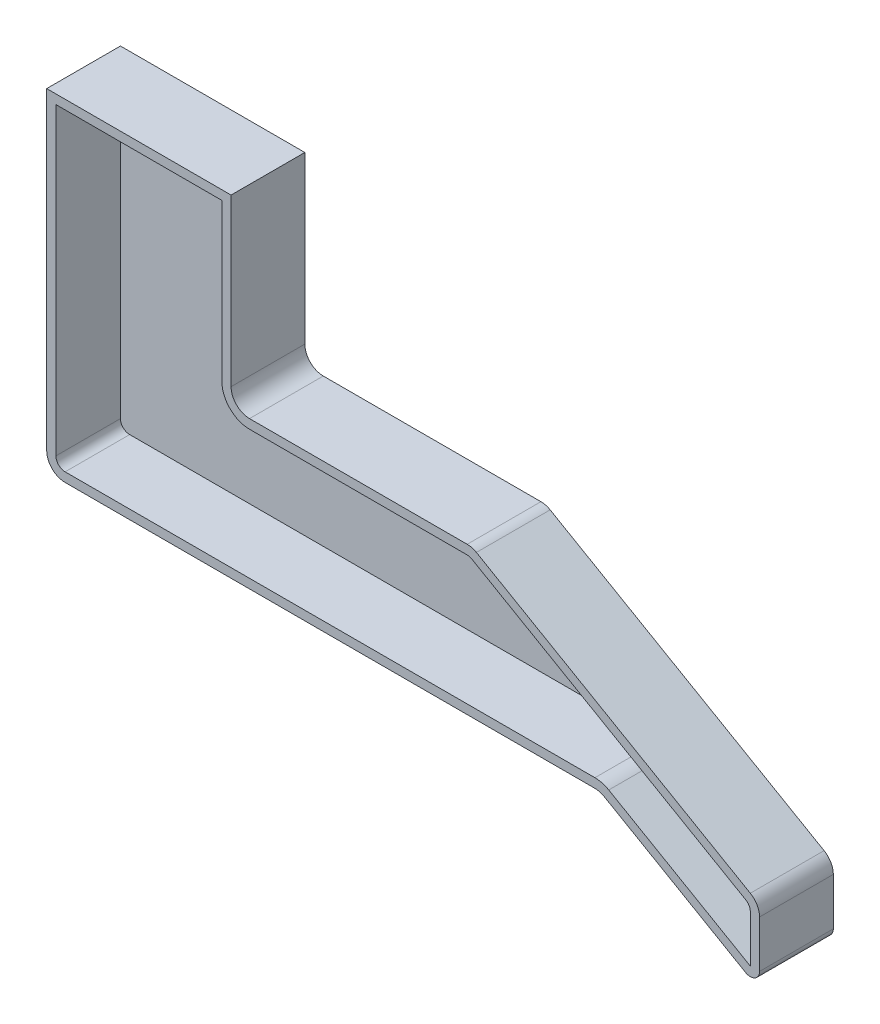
SolidWorks part; units mm, degrees
ref_plane "Front Plane" through (0, 0, 0) normal (0, 0, 1) x (1, 0, 0)
ref_plane "Top Plane" through (0, 0, 0) normal (0, 1, 0) x (1, 0, 0)
ref_plane "Right Plane" through (0, 0, 0) normal (1, 0, 0) x (0, 0, -1)
sketch "Sketch1" plane through (0, 0, 0) normal (0, 0, 1) x (1, 0, 0)
  line L0 (0, 0) -> (50, 0)
  line L1 (50, 0) -> (50, -45)
  line L2 (55, -50) -> (114.0192, -50)
  line L3 (0, 0) -> (0, -85)
  line L4 (5, -90) -> (148.6603, -90)
  line L5 (151.1603, -90.6699) -> (189.5513, -112.8349)
  line L6 (190.8013, -93.5566) -> (116.5192, -50.6699)
  line L7 (193.3013, -97.8868) -> (193.3013, -110.6699)
  line L8 (193.3013, -115) -> (192.7225, -114.3456)
  arc A0 (189.5513, -112.8349) -> (193.3013, -110.6699) centre (190.8013, -110.6699) ccw
  arc A1 (190.8013, -93.5566) -> (193.3013, -97.8868) centre (188.3013, -97.8868) cw
  arc A2 (148.6603, -90) -> (151.1603, -90.6699) centre (148.6603, -95) cw
  arc A3 (114.0192, -50) -> (116.5192, -50.6699) centre (114.0192, -55) cw
  arc A4 (50, -45) -> (55, -50) centre (55, -45) ccw
  arc A5 (0, -85) -> (5, -90) centre (5, -85) ccw
  point P15 (193.3013, -95)
  point P18 (150, -90)
  point P25 (0, -90)
  dimension "D3" = 2.5
  dimension "D8" = 5
  dimension "D1" = 90
  dimension "D2" = 150
  dimension "D4" = 40
  dimension "D5" = 20
  dimension "D6" = 210
  dimension "D7" = 50
  dimension "D9" = 90
  dimension "D10" = 50
extrude "Extrude1" add sketch "Sketch1" along normal blind 20 contours L3 A5 L4 A2 L5 A0 L7 A1 L6 A3 L2 A4 L1 L0
shell "Shell1" thickness 2.5
shell "Shell2" [suppressed] thickness 2.5
sketch "Sketch2" plane through (0, 0, 2.5) normal (0, 0, 1) x (1, 0, 0)
  line L0 (0, 0) -> (50, 0) construction
  line L1 (0, 0) -> (0, -85) construction
  circle A0 centre (15, -10) radius 2.5
  circle A1 centre (35, -10) radius 2.5
  dimension "D2" = 5
  dimension "D3" = 5
  dimension "D1" = 10
  dimension "D4" = 10
  dimension "D5" = 20
  dimension "D6" = 15
extrude "Extrude2" cut sketch "Sketch2" against normal through all
sketch "Sketch3" [suppressed] plane through (0, 0, 17.5) normal (0, 0, -1) x (-1, 0, 0)
  line L0 (0, 0) -> (-50, 0) construction
  line L1 (0, 0) -> (0, -85) construction
  circle A0 centre (-35, -10) radius 2.5
  circle A1 centre (-15, -10) radius 2.5
  dimension "D4" = 5
  dimension "D5" = 5
  dimension "D1" = 20
  dimension "D2" = 10
  dimension "D3" = 10
  dimension "D6" = 15
extrude "Extrude3" [suppressed] cut sketch "Sketch3" against normal through all
